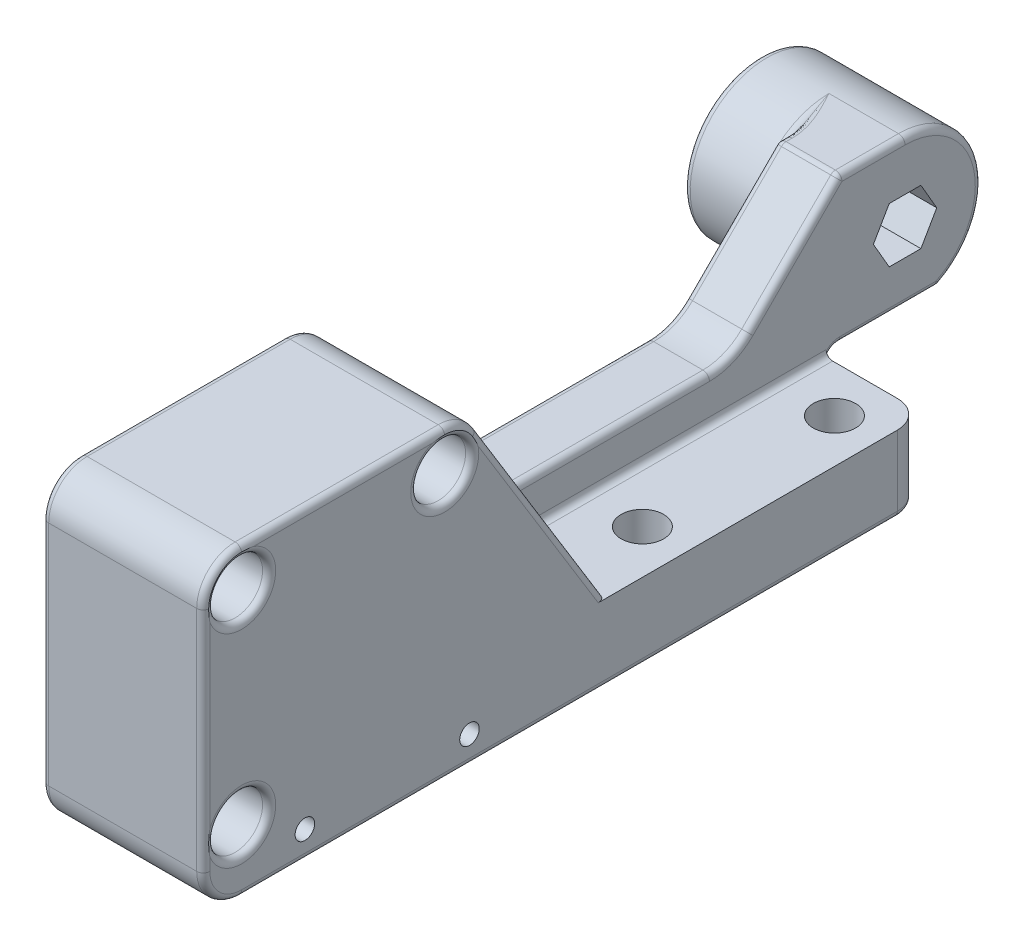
SolidWorks part; units mm, degrees
ref_plane "Front Plane" through (0, 0, 0) normal (0, 0, 1) x (1, 0, 0)
ref_plane "Top Plane" through (0, 0, 0) normal (0, 1, 0) x (1, 0, 0)
ref_plane "Right Plane" through (0, 0, 0) normal (1, 0, 0) x (0, 0, -1)
sketch "Sketch2" plane through (0, 0, 0) normal (1, 0, 0) x (0, 0, -1)
  line L0 (11.75, 11.75) -> (-11.75, 11.75) construction
  line L6 (-11.75, -11.75) -> (-11.75, 11.75) construction
  line L8 (30.4076, -10.16) -> (51.3715, -10.16)
  line L13 (0, 11.75) -> (0, 0) construction
  line L14 (-11.75, 0) -> (0, 0) construction
  line L15 (0, -7.95) -> (76.454, -7.95) construction
  line L23 (11.75, 16.195) -> (-11.75, 16.195)
  line L26 (-11.75, -11.75) -> (11.75, -11.75) construction
  line L27 (11.75, -11.75) -> (11.75, 11.75) construction
  line L28 (-11.75, -19.05) -> (67.31, -19.05)
  line L30 (-16.195, 11.75) -> (-16.195, -14.605)
  line L32 (15.5387, 14.0745) -> (30.4076, -10.16)
  line L34 (76.454, 7.3025) -> (68.834, 7.3025)
  line L39 (80.4575, -9.525) -> (67.31, -9.525)
  line L40 (67.31, -9.525) -> (67.31, -19.05)
  line L41 (68.834, 7.3025) -> (51.3715, -10.16)
  arc A5 (80.4575, -9.525) -> (76.454, 7.3025) centre (76.454, -1.5875) ccw
  circle A9 centre (-11.75, 11.75) radius 4.445 construction
  arc A10 (-11.75, 16.195) -> (-16.195, 11.75) centre (-11.75, 11.75) ccw
  circle A13 centre (11.75, 11.75) radius 4.445 construction
  arc A14 (15.5387, 14.0745) -> (11.75, 16.195) centre (11.75, 11.75) ccw
  arc A15 (-11.75, -19.05) -> (-16.195, -14.605) centre (-11.75, -14.605) cw
  point P23 (30.5, -7.95)
  point P29 (11.364, 17.78)
  dimension "D2" = 30.5
  dimension "D7" = 67.31
  dimension "D8" = 3.175
  dimension "D10" = 8.89
  dimension "D18" = 8.89
  dimension "D5" = 76.454
  dimension "D14" = 7.62
  dimension "D1" = 23.5
  dimension "D3" = 23.5
  dimension "D4" = 10.16
  dimension "D6" = 121.531
  dimension "D9" = 3.8
  dimension "D11" = 0.635
  dimension "D12" = 8.89
  dimension "D13" = 7.95
  dimension "D15" = 45
extrude "Boss-Extrude2" add sketch "Sketch2" against normal blind 18.6499
sketch "Sketch3" plane through (0, -10.16, 0) normal (0, 1, 0) x (1, 0, 0)
  line L1 (0, 30.4076) -> (-11.43, 30.4076)
  line L2 (0, 30.4076) -> (0, 85.344)
  line L3 (0, 85.344) -> (-11.43, 85.344)
  line L4 (-11.43, 30.4076) -> (-11.43, 85.344)
  line L5 (0, 85.344) -> (-18.6499, 85.344) construction
  dimension "D1" = 11.43
extrude "Cut-Extrude1" cut sketch "Sketch3" along normal through all
sketch "Sketch17" plane through (-18.6499, 0, 0) normal (-1, 0, 0) x (0, 0, 1)
  line L0 (-56.4515, -5.08) -> (-51.3715, -10.16)
  line L1 (-68.834, 7.3025) -> (-51.3715, -10.16) construction
  line L2 (-51.3715, -10.16) -> (-30.4076, -10.16)
  line L3 (-30.4076, -10.16) -> (-15.5387, 14.0745) construction
  line L4 (-51.3715, -10.16) -> (-30.4076, -10.16) construction
  line L5 (-30.4076, -10.16) -> (-27.2908, -5.08)
  line L6 (-27.2908, -5.08) -> (-56.4515, -5.08)
  dimension "D1" = 5.08
extrude "Boss-Extrude5" add sketch "Sketch17" against normal up to surface (7.2199 mm away)
ref_plane "Plane1" through (0, 0, -76.454) normal (0, 0, 1) x (1, 0, 0)
hole_wizard "#4-40 Tapped Hole1" positions "Sketch4" profile "Sketch5" tap size "#4-40" standard "ANSI Inch"
sketch "Sketch4" plane through (0, 0, 0) normal (1, 0, 0) x (0, 0, -1)
  circle A0 centre (14.6149, -15.875) radius 1.7272 construction
  circle A1 centre (-4.4351, -15.875) radius 1.7272 construction
  point P0 (14.6149, -15.875)
  point P2 (-4.4351, -15.875)
sketch "Sketch5" plane through (0, -15.875, -14.6149) normal (0, 1, 0) x (0, 0, -1)
  line L0 (0, 0) -> (0, 18.6499)
  line L1 (0, 18.6499) -> (1.1303, 18.6499)
  line L2 (1.1303, 18.6499) -> (1.1303, 0)
  line L5 (1.1303, 0) -> (0, 0)
  line L11 (0, -6.35) -> (0, 107.95) construction
  dimension "Thru Tap Drill Dia." = 2.2606
  dimension "Thru Tap Drill Depth" = 18.6499
hole_wizard "CBORE for #4 Socket Head Cap Screw1" positions "Sketch6" profile "Sketch7" counterbore size "#4" standard "ANSI Inch"
sketch "Sketch6" plane through (0, 0, 0) normal (1, 0, 0) x (0, 0, -1)
  point P0 (-11.75, 11.75)
  point P3 (-11.75, -11.75)
  point P6 (11.75, 11.75)
sketch "Sketch7" plane through (0, 11.75, 11.75) normal (0, 1, 0) x (0, 0, -1)
  line L0 (0, 0) -> (0, 18.6499)
  line L1 (0, 18.6499) -> (2.1082, 18.6499)
  line L3 (2.1082, 18.6499) -> (2.1082, 8.89)
  line L4 (2.1082, 8.89) -> (3.175, 8.89)
  line L5 (3.175, 8.89) -> (3.175, 0)
  line L7 (3.175, 0) -> (0, 0)
  line L11 (0, -6.35) -> (0, 107.95) construction
  dimension "Thru Hole Dia." = 4.2164
  dimension "Thru Hole Depth" = 18.6499
  dimension "C'Bore Dia." = 6.35
  dimension "C'Bore Depth" = 8.89
sketch "Sketch8" plane through (-18.6499, 0, 0) normal (-1, 0, 0) x (0, 0, 1)
  line L6 (-80.4575, -9.525) -> (-72.4505, -9.525)
  line L7 (-80.4575, -9.525) -> (-67.31, -9.525) construction
  arc A2 (-80.4575, -9.525) -> (-72.4505, -9.525) centre (-76.454, -1.5875) cw
  arc A4 (-76.454, 7.3025) -> (-80.4575, -9.525) centre (-76.454, -1.5875) ccw construction
extrude "Boss-Extrude3" add sketch "Sketch8" along normal blind 9.525
sketch "Sketch16" plane through (-28.1749, 0, 0) normal (-1, 0, 0) x (0, 0, 1)
  circle A0 centre (-76.454, -1.5875) radius 4.445
  arc A1 (-72.4505, -9.525) -> (-80.4575, -9.525) centre (-76.454, -1.5875) ccw construction
  dimension "D1" = 8.89
extrude "Boss-Extrude4" add sketch "Sketch16" along normal blind 1.016
sketch "Sketch9" plane through (-11.43, 0, 0) normal (1, 0, 0) x (0, 0, -1)
  line L1 (78.2871, 1.5875) -> (74.6209, 1.5875)
  line L2 (74.6209, 1.5875) -> (72.7878, -1.5875)
  line L3 (72.7878, -1.5875) -> (74.6209, -4.7625)
  line L4 (74.6209, -4.7625) -> (78.2871, -4.7625)
  line L5 (78.2871, -4.7625) -> (80.1202, -1.5875)
  line L6 (80.1202, -1.5875) -> (78.2871, 1.5875)
  circle A0 centre (76.454, -1.5875) radius 3.175 construction
  arc A1 (80.4575, -9.525) -> (76.454, 7.3025) centre (76.454, -1.5875) ccw construction
  dimension "D1" = 6.35
extrude "Cut-Extrude2" cut sketch "Sketch9" against normal through all
fillet "Fillet1" radius 6.35 2 edges at (-15.04, -5.08, -27.2908) (-15.04, -5.08, -56.4515)
fillet "Fillet3" radius 1.5875 3 edges at (-18.6499, -9.525, -69.8802) (-18.6499, 0.4701, -67.8054) (-23.4124, -9.525, -72.4505)
hole_wizard "CBORE for #8 Socket Head Cap Screw1" positions "Sketch14" profile "Sketch15" counterbore size "#8" standard "ANSI Inch"
sketch "Sketch14" plane through (0, -19.05, 0) normal (0, -1, 0) x (-1, 0, 0)
  circle A2 centre (5.0799, 39.7038) radius 2.0828 construction
  circle A3 centre (5.0799, 61.9288) radius 2.0828 construction
  point P2 (5.0799, 39.7038)
  point P12 (5.0799, 61.9288)
  point P15 (0, 0)
  point P16 (0, 0)
  point P17 (0, 0)
sketch "Sketch15" plane through (-5.0799, -19.05, -39.7038) normal (1, 0, 0) x (0, 0, -1)
  line L0 (0, 0) -> (0, 35.245)
  line L1 (0, 35.245) -> (2.4574, 35.245)
  line L3 (2.4574, 35.245) -> (2.4575, 5.4356)
  line L4 (2.4575, 5.4356) -> (3.9687, 5.4356)
  line L5 (3.9687, 5.4356) -> (3.9688, 0)
  line L7 (3.9688, 0) -> (0, 0)
  line L11 (0, -6.35) -> (0, 107.95) construction
  dimension "Thru Hole Dia." = 4.9149
  dimension "Thru Hole Depth" = 35.245
  dimension "C'Bore Dia." = 7.9375
  dimension "C'Bore Depth" = 5.4356
ref_plane "Plane2" through (0, -1.5875, 0) normal (0, 1, 0) x (1, 0, 0)
fillet "Fillet5" radius 3.175 1 edges at (0, -14.605, -67.31)
fillet "Fillet4" radius 0.762 27 edges at (-19.8025, -9.525, -80.4575) (-18.6499, -13.4937, -67.31) (-18.6499, 6.0119, -20.4855) (-18.6499, 15.6288, -13.9209) (-18.6499, 16.195, 0) (-18.6499, 14.8931, 14.8931) (-18.6499, -1.4275, 16.195) (-18.6499, -17.7481, 14.8931) (-18.6499, -19.05, -27.78) (-10.9125, -19.05, -67.31) (0, 1.9573, -22.9732) (0, 15.6288, -13.9209) (0, 16.195, 0) (0, 14.8931, 14.8931) (0, -1.4275, 16.195) (0, -17.7481, 14.8931) (0, -19.05, -26.1925) (-0.9299, -19.05, -66.3801) (-11.43, 0.4701, -85.1026) (-11.43, 7.3025, -72.644) (0, -11.75, 8.575) (0, 11.75, -14.925) (0, 11.75, 8.575) (-18.6499, 2.0412, -63.5727) (-18.6499, -4.5966, -56.2513) (-18.6499, -5.08, -42.333) (-18.6499, -4.2712, -27.7435)
fillet "Fillet6" radius 0.762 11 edges at (-11.43, -5.08, -42.333) (-11.43, -10.16, -48.8588) (-11.43, -6.1054, -27.9199) (-11.43, -4.2712, -27.7435) (-19.0688, 7.3025, -73.3906) (-18.6499, 7.3025, -70.4104) (-18.4268, 7.3025, -69.1496) (-15.04, 7.3025, -68.834) (-11.6532, 7.0793, -68.6108) (-11.43, 1.6602, -63.1917) (-11.43, -4.5966, -56.2513)
fillet "Fillet7" radius 1.5875 3 edges at (-14.2462, -9.525, -67.31) (-18.4522, -8.7048, -67.0601) (-17.4911, -9.466, -67.31)
fillet "Fillet8" radius 0.762 4 edges at (-28.1749, -9.525, -76.5599) (-28.1749, -9.5023, -80.4564) (-28.1749, 7.3017, -76.5762) (-28.1749, -9.4724, -72.4425)
fillet "Fillet10" radius 0.635 4 edges at (-11.6542, -9.525, -79.9363) (-11.43, -9.99, -67.775) (-11.43, -9.525, -73.5505) (-12.1086, -9.4723, -80.5505)
